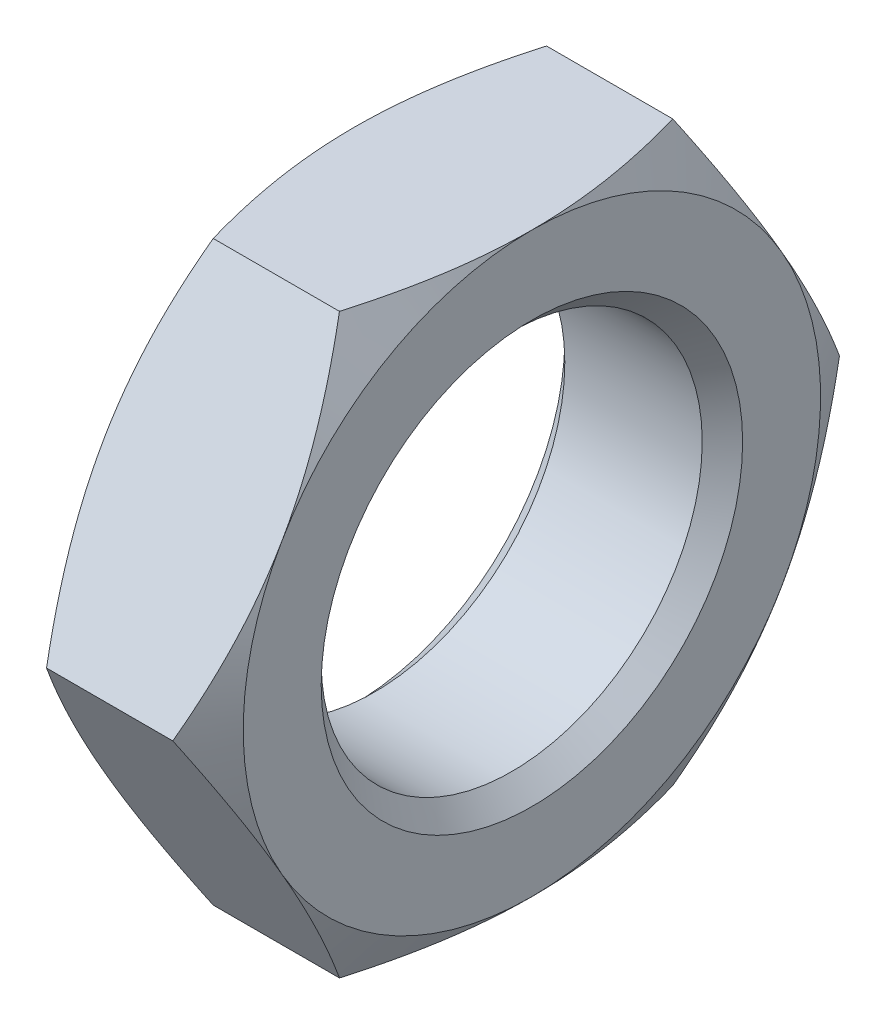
SolidWorks part; units mm, degrees
ref_plane "Front Plane" through (0, 0, 0) normal (0, 0, 1) x (1, 0, 0)
ref_plane "Top Plane" through (0, 0, 0) normal (0, 1, 0) x (1, 0, 0)
ref_plane "Right Plane" through (0, 0, 0) normal (1, 0, 0) x (0, 0, -1)
sketch "Sketch1" plane through (0, 0, 0) normal (1, 0, 0) x (0, 0, -1)
  line L1 (14.4338, 25) -> (-14.4338, 25)
  line L2 (-14.4338, 25) -> (-28.8675, 0)
  line L3 (-28.8675, 0) -> (-14.4338, -25)
  line L4 (-14.4338, -25) -> (14.4338, -25)
  line L5 (14.4338, -25) -> (28.8675, 0)
  line L6 (28.8675, 0) -> (14.4338, 25)
  circle A0 centre (0, 0) radius 25 construction
  circle A1 centre (0, 0) radius 16.5
extrude "Extrude1" add sketch "Sketch1" along normal blind 15.4
sketch "Sketch2" plane through (0, 0, 0) normal (0, 0, 1) x (1, 0, 0)
  line L0 (15.4, 25) -> (15.4, 100)
  line L1 (15.4, 100) -> (0, 100)
  line L2 (0, 100) -> (0, 25)
  line L3 (0, 25) -> (7.7, 38.3368)
  line L4 (7.7, 38.3368) -> (15.4, 25)
revolve "Cut-Revolve1" cut sketch "Sketch2" angle 360 about axis through (15.4, 0, 0) along (-1, 0, 0)
chamfer "Chamfer1" distance 1.75 angle 45 2 edges at (0, 0, -16.5) (15.4, 0, -16.5)
equation "\"D2@Sketch2\"=\"D1@Sketch1\"*2"
